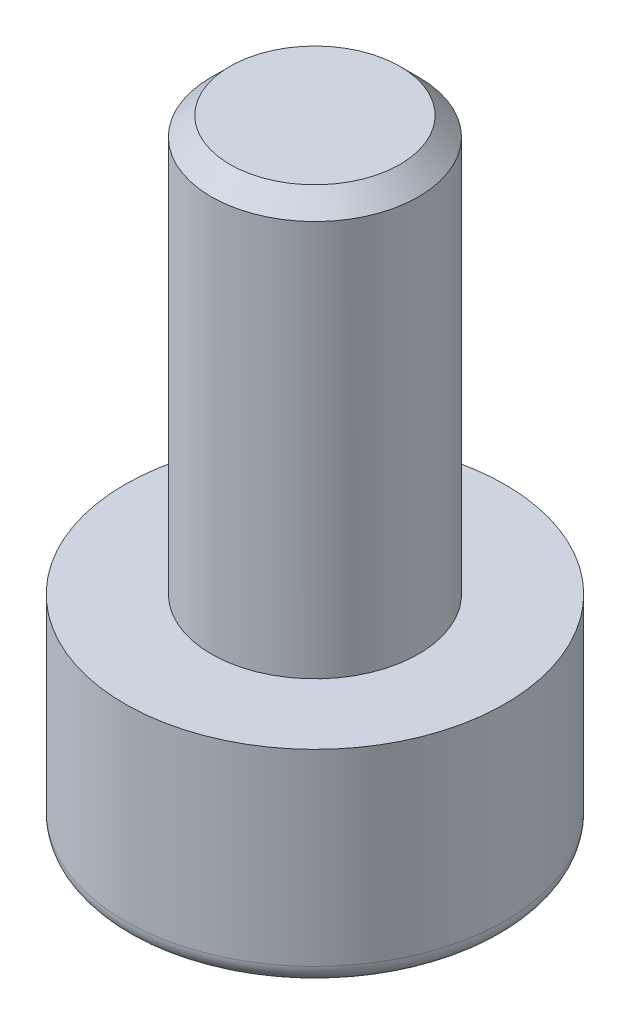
SolidWorks part; units mm, degrees
ref_plane "Alzado" through (0, 0, 0) normal (0, 0, 1) x (1, 0, 0)
ref_plane "Planta" through (0, 0, 0) normal (0, 1, 0) x (1, 0, 0)
ref_plane "Vista lateral" through (0, 0, 0) normal (1, 0, 0) x (0, 0, -1)
sketch "Croquis1" plane through (0, 0, 0) normal (0, 0, 1) x (1, 0, 0)
  line L0 (0, 0) -> (2.75, 0)
  line L1 (2.75, 0) -> (2.75, 3)
  line L2 (2.75, 3) -> (1.5, 3)
  line L3 (1.5, 3) -> (1.5, 9)
  line L4 (1.5, 9) -> (0, 9)
  line L5 (0, 9) -> (0, 0)
  dimension "D1" = 3
  dimension "D2" = 9
  dimension "D3" = 2.75
  dimension "D4" = 1.5
revolve "Revolución1" add sketch "Croquis1" angle 360 about L5
sketch "Croquis2" plane through (0, 0, 0) normal (0, -1, 0) x (1, 0, 0)
  line L1 (0.8343, 1.445) -> (-0.8343, 1.445)
  line L2 (-0.8343, 1.445) -> (-1.6685, 0)
  line L3 (-1.6685, 0) -> (-0.8343, -1.445)
  line L4 (-0.8343, -1.445) -> (0.8343, -1.445)
  line L5 (0.8343, -1.445) -> (1.6685, 0)
  line L6 (1.6685, 0) -> (0.8343, 1.445)
  circle A0 centre (0, 0) radius 1.445 construction
  point P1 (0, 1.445)
  dimension "D1" = 2.89
extrude "Cortar-Extruir1" cut sketch "Croquis2" against normal blind 2
fillet "Redondeo1" radius 0.28 1 edges at (-2.75, 0, 0)
chamfer "Chaflán1" distance 0.27 angle 45 1 edges at (-1.5, 9, 0)
